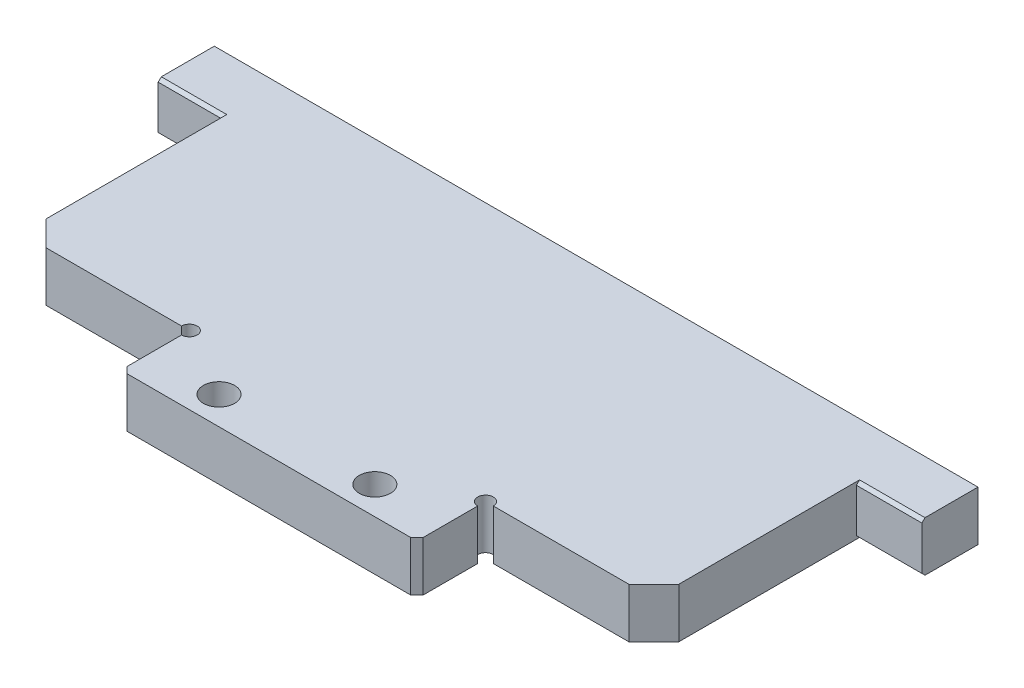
SolidWorks part; units mm, degrees
ref_plane "Front" through (0, 0, 0) normal (0, 0, 1) x (1, 0, 0)
ref_plane "Top" through (0, 0, 0) normal (0, 1, 0) x (1, 0, 0)
ref_plane "Right" through (0, 0, 0) normal (1, 0, 0) x (0, 0, -1)
sketch "Sketch1" plane through (0, 0, 0) normal (0, 1, 0) x (1, 0, 0)
  line L1 (-122.5, 105) -> (122.5, 105)
  line L2 (-122.5, 105) -> (-122.5, 0)
  line L3 (-122.5, 0) -> (122.5, 0)
  line L4 (122.5, 105) -> (122.5, 0)
  dimension "D1" = 245
  dimension "D2" = 105
extrude "Boss-Extrude1" add sketch "Sketch1" along normal blind 16
sketch "Sketch2" plane through (0, 16, 0) normal (0, 1, 0) x (1, 0, 0)
  line L0 (0, 0) -> (0, 19.9229) construction
  line L1 (-122.5, 0) -> (-47.5, 0)
  line L2 (-122.5, 0) -> (-122.5, 22)
  line L3 (-122.5, 22) -> (-47.5, 22)
  line L4 (-47.5, 0) -> (-47.5, 22)
  line L5 (47.5, 0) -> (47.5, 22)
  line L6 (122.5, 22) -> (47.5, 22)
  line L7 (122.5, 0) -> (122.5, 22)
  line L8 (122.5, 0) -> (47.5, 0)
  dimension "D1" = 22
  dimension "D2" = 95
extrude "Cut-Extrude1" cut sketch "Sketch2" against normal through all
sketch "Sketch3" plane through (0, 16, 0) normal (0, 1, 0) x (1, 0, 0)
  circle A0 centre (-47.5, 22) radius 2.5
  circle A1 centre (47.5, 22) radius 2.5
  dimension "D1" = 5
extrude "Cut-Extrude2" cut sketch "Sketch3" against normal through all
chamfer "Chamfer1" distance 2 angle 45 2 edges at (-47.5, 8, 0) (47.5, 8, 0)
sketch "Sketch4" plane through (0, 16, 0) normal (0, 1, 0) x (1, 0, 0)
  line L0 (-25, 9) -> (25, 9) construction
  line L1 (0, 0) -> (0, 9) construction
  line L2 (122.5, 22) -> (50, 22) construction
  circle A0 centre (-25, 9) radius 5
  circle A1 centre (25, 9) radius 5
  dimension "D2" = 10
  dimension "D1" = 50
  dimension "D3" = 13
extrude "Cut-Extrude3" cut sketch "Sketch4" against normal through all
sketch "Sketch5" plane through (0, 16, 0) normal (0, 1, 0) x (1, 0, 0)
  line L0 (0, 0) -> (0, 105) construction
  line L1 (-122.5, 22) -> (-101.5, 22)
  line L2 (-122.5, 22) -> (-122.5, 87)
  line L3 (-122.5, 87) -> (-101.5, 87)
  line L4 (-101.5, 22) -> (-101.5, 87)
  line L5 (122.5, 105) -> (-122.5, 105) construction
  line L6 (101.5, 22) -> (101.5, 87)
  line L7 (122.5, 87) -> (101.5, 87)
  line L8 (122.5, 22) -> (122.5, 87)
  line L9 (122.5, 22) -> (101.5, 22)
  dimension "D1" = 21
  dimension "D2" = 65
extrude "Cut-Extrude4" cut sketch "Sketch5" against normal through all
chamfer "Chamfer2" distance 8 angle 45 2 edges at (101.5, 8, -22) (-101.5, 8, -22)
chamfer "Chamfer3" distance 1 angle 45 4 edges at (112, 0, -87) (112, 16, -87) (-112, 0, -87) (-112, 16, -87)
